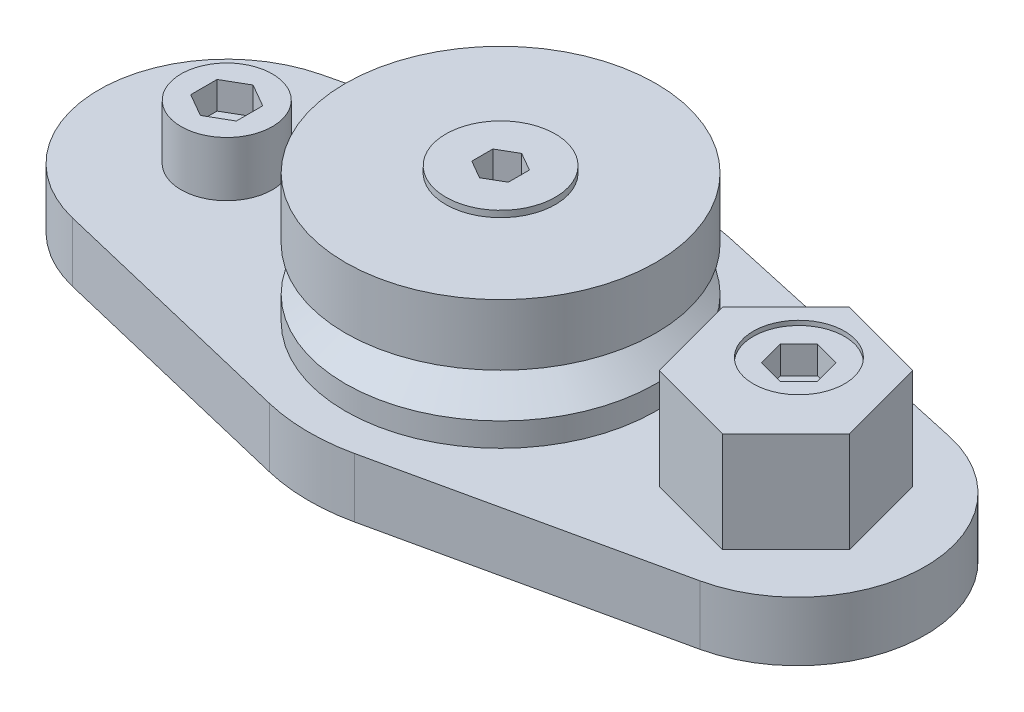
SolidWorks part; units mm, degrees
ref_plane "Ebene vorne" through (0, 0, 0) normal (0, 0, 1) x (1, 0, 0)
ref_plane "Ebene oben" through (0, 0, 0) normal (0, 1, 0) x (1, 0, 0)
ref_plane "Ebene rechts" through (0, 0, 0) normal (1, 0, 0) x (0, 0, -1)
ref_plane "Ebene1" through (0, 0, 0) normal (0, 1, 0) x (1, 0, 0)
sketch "Skizze1" plane through (0, 0, 0) normal (0, 1, 0) x (1, 0, 0)
  line L0 (-33.2667, -13.6136) -> (-4.9, -20.4203)
  line L1 (4.5231, -20.5071) -> (35.5154, -13.6714)
  line L2 (35.5154, 13.6714) -> (4.5231, 20.5071)
  line L3 (-4.9, 20.4203) -> (-33.2667, 13.6136)
  line L4 (27.5, -6.325) -> (32.5, -6.325)
  line L5 (32.5, 6.325) -> (27.5, 6.325)
  arc A0 (-33.2667, 13.6136) -> (-33.2667, -13.6136) centre (-30, 0) ccw
  arc A1 (-4.9, -20.4203) -> (4.5231, -20.5071) centre (0, 0) ccw
  arc A2 (35.5154, -13.6714) -> (35.5154, 13.6714) centre (32.5, 0) ccw
  arc A3 (4.5231, 20.5071) -> (-4.9, 20.4203) centre (0, 0) ccw
  arc A4 (27.5, 6.325) -> (27.5, -6.325) centre (27.5, 0) ccw
  arc A5 (32.5, -6.325) -> (32.5, 6.325) centre (32.5, 0) ccw
  circle A6 centre (-30, 0) radius 3.3
extrude "Aufsatz-Linear austragen1" add sketch "Skizze1" along normal blind 6.5
ref_plane "Ebene2" through (0, 0, 0) normal (0, 0, 1) x (1, 0, 0)
sketch "Skizze2" plane through (0, 0, 0) normal (0, 0, 1) x (1, 0, 0)
  line L0 (0, 21.3) -> (6, 21.3)
  line L1 (6, 21.3) -> (6, 20.6)
  line L2 (6, 20.6) -> (17, 20.6)
  line L3 (17, 20.6) -> (17, 13.9052)
  line L4 (17, 13.9052) -> (13.565, 11.5)
  line L5 (13.565, 11.5) -> (17, 9.0948)
  line L6 (17, 9.0948) -> (17, 0)
  line L7 (17, 0) -> (0, 0)
  line L8 (0, 0) -> (0, 21.3)
  line L9 (0, 0) -> (0, 21.3) construction
revolve "Rotation1" add sketch "Skizze2" angle 360 about L9
ref_plane "Ebene3" through (0, 21.3, 0) normal (0, 1, 0) x (1, 0, 0)
sketch "Skizze3" plane through (0, 21.3, 0) normal (0, 1, 0) x (1, 0, 0)
  line L0 (-2, -1.1547) -> (0, -2.3094)
  line L1 (0, -2.3094) -> (2, -1.1547)
  line L2 (2, -1.1547) -> (2, 1.1547)
  line L3 (2, 1.1547) -> (0, 2.3094)
  line L4 (0, 2.3094) -> (-2, 1.1547)
  line L5 (-2, 1.1547) -> (-2, -1.1547)
extrude "Schnitt-Linear austragen1" cut sketch "Skizze3" against normal blind 3
ref_plane "Ebene4" through (0, 0, 0) normal (0, 0, 1) x (1, 0, 0)
sketch "Skizze4" plane through (0, 0, 0) normal (0, 0, 1) x (1, 0, 0)
  line L0 (-30, 12.5) -> (-25, 12.5)
  line L1 (-25, 12.5) -> (-25, 6.5)
  line L2 (-25, 6.5) -> (-27, 6.5)
  line L3 (-27, 6.5) -> (-27, -8.8865)
  line L4 (-27, -8.8865) -> (-27.6135, -9.5)
  line L5 (-27.6135, -9.5) -> (-30, -9.5)
  line L6 (-30, -9.5) -> (-30, 12.5)
  line L7 (-30, -9.5) -> (-30, 12.5) construction
revolve "Rotation2" add sketch "Skizze4" angle 360 about L7
ref_plane "Ebene5" through (0, 12.5, 0) normal (0, 1, 0) x (1, 0, 0)
sketch "Skizze5" plane through (0, 12.5, 0) normal (0, 1, 0) x (1, 0, 0)
  line L0 (-32.5, -1.4434) -> (-30, -2.8868)
  line L1 (-30, -2.8868) -> (-27.5, -1.4434)
  line L2 (-27.5, -1.4434) -> (-27.5, 1.4434)
  line L3 (-27.5, 1.4434) -> (-30, 2.8868)
  line L4 (-30, 2.8868) -> (-32.5, 1.4434)
  line L5 (-32.5, 1.4434) -> (-32.5, -1.4434)
extrude "Schnitt-Linear austragen2" cut sketch "Skizze5" against normal blind 3
ref_plane "Ebene6" through (0, 17.5, 0) normal (0, 1, 0) x (1, 0, 0)
sketch "Skizze6" plane through (0, 17.5, 0) normal (0, 1, 0) x (1, 0, 0)
  line L0 (21.7795, 2.5403) -> (24.3198, -6.9402)
  line L1 (24.3198, -6.9402) -> (33.8003, -9.4805)
  line L2 (33.8003, -9.4805) -> (40.7405, -2.5403)
  line L3 (40.7405, -2.5403) -> (38.2002, 6.9402)
  line L4 (38.2002, 6.9402) -> (28.7197, 9.4805)
  line L5 (28.7197, 9.4805) -> (21.7795, 2.5403)
extrude "Aufsatz-Linear austragen2" add sketch "Skizze6" against normal blind 11
ref_plane "Ebene7" through (0, 17.5, 0) normal (0, 1, 0) x (1, 0, 0)
sketch "Skizze7" plane through (0, 17.5, 0) normal (0, 1, 0) x (1, 0, 0)
  line L0 (27.954, 2.679) -> (28.7011, -0.1094)
  line L1 (28.7011, -0.1094) -> (31.4895, -0.8565)
  line L2 (31.4895, -0.8565) -> (33.5307, 1.1847)
  line L3 (33.5307, 1.1847) -> (32.7836, 3.9731)
  line L4 (32.7836, 3.9731) -> (29.9952, 4.7202)
  line L5 (29.9952, 4.7202) -> (27.954, 2.679)
extrude "Schnitt-Linear austragen3" cut sketch "Skizze7" against normal blind 3.5
ref_plane "Ebene8" through (29.166, 0, -7.815) normal (0.9659, 0, -0.2588) x (-0.2588, 0, -0.9659)
sketch "Skizze8" plane through (29.166, 0, -7.815) normal (0.9659, 0, -0.2588) x (-0.2588, 0, -0.9659)
  line L0 (-6.0907, 17.5) -> (-1.0907, 17.5)
  line L1 (-1.0907, 17.5) -> (-1.0907, 17)
  line L2 (-1.0907, 17) -> (-6.0907, 17)
  line L3 (-6.0907, 17) -> (-6.0907, 17.5)
  line L4 (-6.0907, 17) -> (-6.0907, 17.5) construction
revolve "Schnitt-Rotation1" cut sketch "Skizze8" angle 360 about L4
ref_plane "Ebene9" through (0, 0, 0) normal (0, 0, 1) x (1, 0, 0)
sketch "Skizze9" plane through (0, 0, 0) normal (0, 0, 1) x (1, 0, 0)
  line L0 (31.26, 6.5) -> (37.565, 6.5)
  line L1 (37.565, 6.5) -> (37.565, 0)
  line L2 (37.565, 0) -> (31.26, 0)
  line L3 (31.26, 0) -> (31.26, 6.5)
  line L4 (31.26, 0) -> (31.26, 6.5) construction
revolve "Rotation3" add sketch "Skizze9" angle 360 about L4
ref_plane "Ebene10" through (29.166, 0, -7.815) normal (0.9659, 0, -0.2588) x (-0.2588, 0, -0.9659)
sketch "Skizze10" plane through (29.166, 0, -7.815) normal (0.9659, 0, -0.2588) x (-0.2588, 0, -0.9659)
  line L0 (-6.0907, 6.5) -> (-3.0907, 6.5)
  line L1 (-3.0907, 6.5) -> (-3.0907, -7.8865)
  line L2 (-3.0907, -7.8865) -> (-3.7042, -8.5)
  line L3 (-3.7042, -8.5) -> (-6.0907, -8.5)
  line L4 (-6.0907, -8.5) -> (-6.0907, 6.5)
  line L5 (-6.0907, -8.5) -> (-6.0907, 6.5) construction
revolve "Rotation4" add sketch "Skizze10" angle 360 about L5
